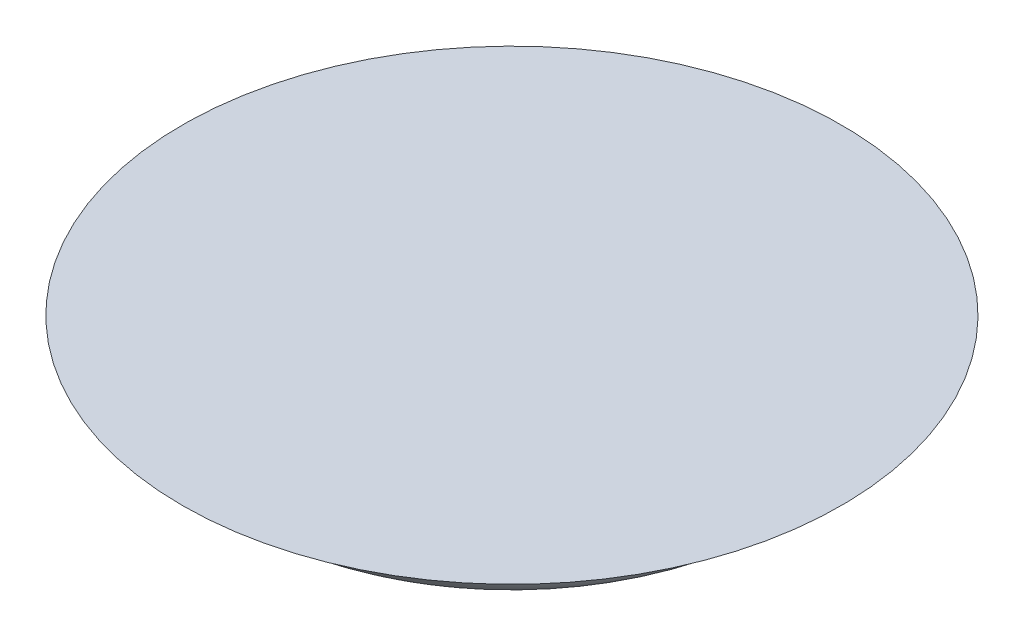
SolidWorks part; units mm, degrees
ref_plane "Plane1" through (0, 0, 0) normal (0, 0, 1) x (1, 0, 0)
ref_plane "Plane2" through (0, 0, 0) normal (0, 1, 0) x (1, 0, 0)
ref_plane "Plane3" through (0, 0, 0) normal (1, 0, 0) x (0, 0, -1)
sketch "Sketch1" plane through (0, 0, 0) normal (0, 0, 1) x (1, 0, 0)
  line L0 (-101.8453, 0) -> (101.8453, 0)
  line L1 (-101.8453, 0) -> (-101.8453, 2)
  line L2 (101.8453, 2) -> (-101.8453, 2)
  line L3 (101.8453, 2) -> (101.8453, 0)
  line L4 (50, 0) -> (-50, 0) construction
  line L5 (0, -25.996) -> (0, 39.4685) construction
  dimension "D1" = 2
extrude "Base-Extrude" add sketch "Sketch1" along normal mid plane 120
sketch "Sketch3" plane through (0, 0, 0) normal (0, -1, 0) x (1, 0, 0)
  circle A0 centre (0, 0) radius 25
  dimension "Diameter" = 50
extrude "Boss-Extrude1" add sketch "Sketch3" along normal blind 5
fillet "Fillet" radius 3 1 edges at (0, -5, -25)
fillet "Fillet2" radius 5 1 edges at (0, 0, 25)
sketch "Sketch4" plane through (101.8453, 0, 0) normal (1, 0, 0) x (0, 0, -1)
  line L4 (60, 0) -> (60, 2)
  line L5 (60, 2) -> (-60, 2)
  line L6 (-60, 2) -> (-60, 0)
  line L7 (-60, 0) -> (60, 0)
  line L8 (60, 0) -> (60, 2)
  line L9 (60, 2) -> (-60, 2)
  line L10 (-60, 2) -> (-60, 0)
  line L11 (-60, 0) -> (60, 0)
  dimension "D1" = 0
extrude "Cut-Extrude1" cut sketch "Sketch4" against normal through all
sketch "Orientation sketch" plane through (0, 0, 0) normal (0, 1, 0) x (-1, 0, 0)
  circle A1 centre (0, 0) radius 29.4162
  circle A2 centre (0, 0) radius 29.4162
  dimension "D1" = 0
